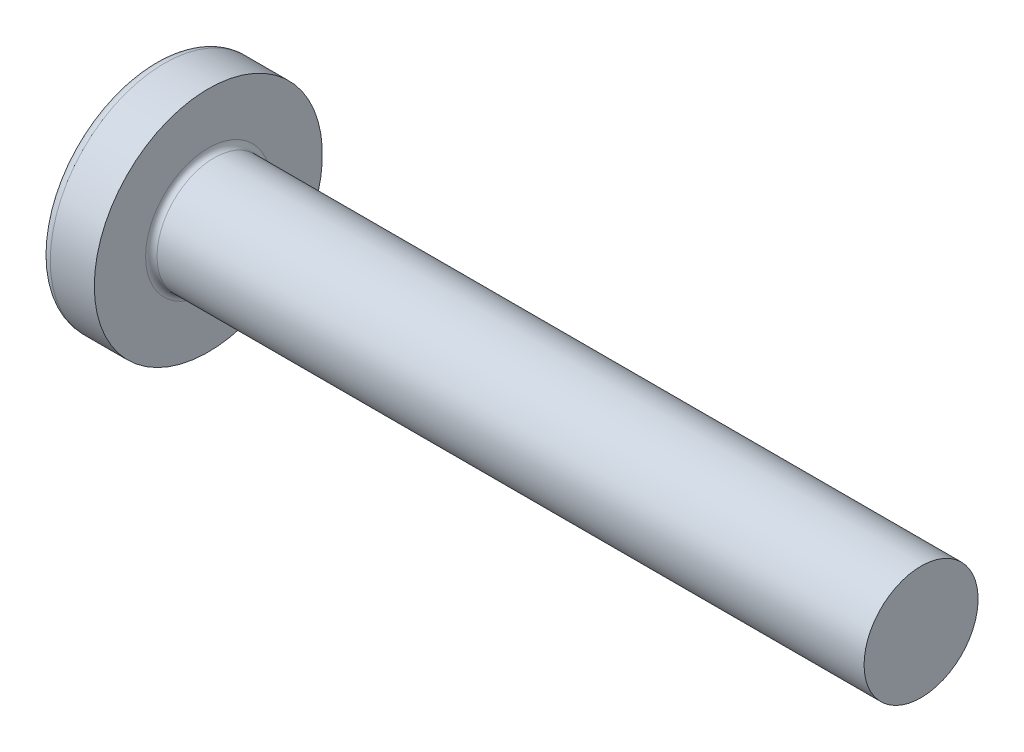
SolidWorks part; units mm, degrees
ref_plane "Plane1" through (0, 0, 0) normal (0, 0, 1) x (1, 0, 0)
ref_plane "Plane2" through (0, 0, 0) normal (0, 1, 0) x (1, 0, 0)
ref_plane "Plane3" through (0, 0, 0) normal (1, 0, 0) x (0, 0, -1)
revolve "Base-Revolve" add sketch "BodySke"
sketch "BodySke" plane through (0, 0, 0) normal (0, 0, 1) x (1, 0, 0)
  line L0 (3.1, 2) -> (3.1, 4)
  line L1 (3.45, 6.35) -> (3.45, -3.175) construction
  line L2 (-25.4, 0) -> (127, 0) construction
  line L3 (28.1, 0) -> (0, 0)
  line L4 (3.1, 2) -> (28.1, 2)
  line L5 (28.1, 2) -> (28.1, 0)
  line L6 (1.5553, 4) -> (3.1, 4)
  line L8 (3.1, 6.35) -> (3.1, -3.175) construction
  arc A0 (1.2654, 3.8534) -> (0, 0) centre (6.5, 0) ccw
  arc A2 (1.2654, 3.8534) -> (1.5553, 4) centre (1.5553, 3.64) cw
  dimension "Head_fillet_rad" = 0.36
  dimension "Head_crown_rad" = 6.5
  dimension "Head_ht" = 3.1
  dimension "Diameter" = 4
  dimension "Length" = 25
  dimension "Head_dia" = 8
  dimension "Advance" = 0.7
  dimension "Thread_nom" = 25
fillet "Fillet1" radius 0.2 1 edges at (3.1, 0, 2)
sketch "Sketch3" plane through (0, 0, 0) normal (1, 0, 0) x (0, 0, -1)
  line L0 (0.515, -2.15) -> (-0.515, -2.15)
  line L1 (0.515, -2.15) -> (0.515, 2.15)
  line L2 (-0.515, 2.15) -> (0.515, 2.15)
  line L3 (-0.515, 2.15) -> (-0.515, -2.15)
  dimension "D1" = 2.15
  dimension "Cross_dia" = 4.3
  dimension "D2" = 0.515
  dimension "Cross_width" = 1.03
ref_plane "Plane4" through (2.34, 0, 0) normal (1, 0, 0) x (0, 0, -1)
sketch "Sketch4" plane through (2.34, 0, 0) normal (1, 0, 0) x (0, 0, -1)
  line L0 (0.515, -0.9833) -> (-0.515, -0.9833)
  line L1 (0.515, -0.9833) -> (0.515, 0.9833)
  line L2 (-0.515, 0.9833) -> (0.515, 0.9833)
  line L3 (-0.515, 0.9833) -> (-0.515, -0.9833)
  dimension "D1" = 1.03
  dimension "D2" = 1.9666
  dimension "D3" = 0.515
  dimension "D4" = 0.9833
loft "Recess" cut profiles "Sketch3", "Sketch4"
pattern_circular "RecPat" count 2 every 90 about axis through (0, 0, 0) along (1, 0, 0) of "Recess"
sketch "RecCorSke" plane through (0, 0, 0) normal (0, 0, 1) x (1, 0, 0)
  line L0 (-3.175, 0) -> (15.875, 0) construction
  line L1 (-25.4, 0) -> (127, 0) construction
  line L2 (0, 0) -> (0, 1.0146)
  line L3 (0, 1.0146) -> (2.34, 0.851)
  line L4 (2.34, 0.851) -> (2.6165, 0)
  line L5 (2.6165, 0) -> (0, 0)
  dimension "Diameter" = 1.702
  dimension "Depth" = 2.34
  dimension "Draft_angle" = 4
  dimension "Bottom_angle" = 18
revolve "RecessCore" cut sketch "RecCorSke" angle 360 about L0
sketch "ThdSchSke" plane through (0, 0, 0) normal (0, 0, 1) x (1, 0, 0)
  line L0 (4.5, -1.61) -> (4.2269, -2)
  line L1 (4.5, -1.61) -> (4.7731, -2)
  line L2 (4.7731, -2) -> (4.7731, -2.5)
  line L3 (-3.175, 0) -> (5.1513, 0) construction
  line L5 (4.7731, -2.5) -> (4.2269, -2.5)
  line L6 (4.2269, -2.5) -> (4.2269, -2)
  dimension "Thread_minor" = 3.22
  dimension "Diameter" = 4
  dimension "Start" = 4.5
  dimension "SideAngle" = 55
  dimension "VeeAngle" = 70
  dimension "Overcut" = 5
revolve "ThreadSchematic" cut sketch "ThdSchSke" angle 360 about L3
pattern_linear "ThdSchPat"
equation "\"D1@Sketch3\" = \"Cross_dia@Sketch3\" / 2"
equation "\"D2@Sketch3\" = \"Cross_width@Sketch3\" / 2"
equation "\"Depth@RecCorSke\" = \"Cross_depth@Plane4\""
equation "\"D1@Sketch4\" = \"Cross_width@Sketch3\""
equation "\"D2@Sketch4\" = \"Cross_dia@Sketch3\" - 2.0 * \"Cross_depth@Plane4\" * tan(26.5  * 0.017453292)"
equation "\"D3@Sketch4\" = \"D1@Sketch4\" / 2"
equation "\"D4@Sketch4\" = \"D2@Sketch4\" / 2"
equation "\"Thread_length@ThreadCosmetic\" = ((sgn( (\"Length@BodySke\" - \"Advance@BodySke\" * 2.0 ) - \"Thread_nom@BodySke\" )-1)*( (\"Length@BodySke\" - \"Advance@BodySke\" * 2.0 ) - \"Thread_nom@BodySke\" ))/-2+ \"Thread_"
equation "\"Thread_minor@ThdSchSke\" = \"Thread_minor@ThreadCosmetic\""
equation "\"Diameter@ThdSchSke\" = \"Diameter@BodySke\""
equation "\"Overcut@ThdSchSke\" = \"Diameter@BodySke\" * 1.25"
equation "\"Start@ThdSchSke\" = \"Head_ht@BodySke\" + \"Length@BodySke\" - \"Thread_length@ThreadCosmetic\"  '---Non-countersunk---"
equation "\"Num_threads@ThdSchPat\" = int( \"Thread_length@ThreadCosmetic\" / \"Advance@BodySke\" + 0.999 )  + 1"
equation "\"Advance@ThdSchPat\" = \"Thread_length@ThreadCosmetic\" /  (\"Num_threads@ThdSchPat\" - 1) 'relax it"
